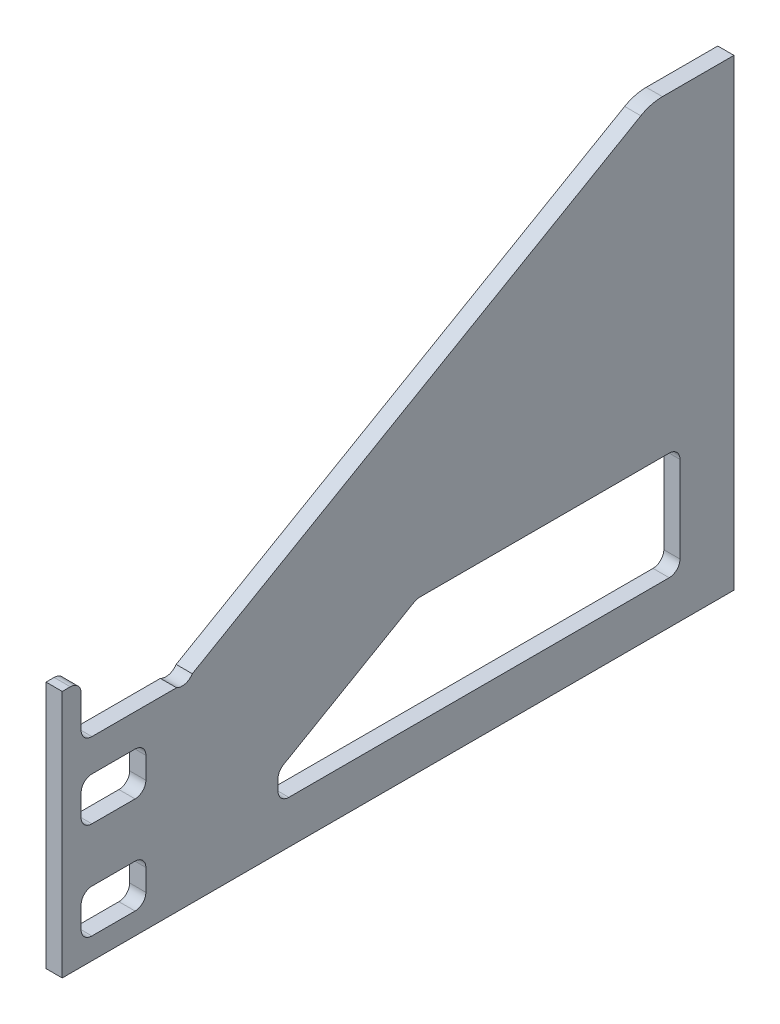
SolidWorks part; units mm, degrees
ref_plane "Front Plane" through (0, 0, 0) normal (0, 0, 1) x (1, 0, 0)
ref_plane "Top Plane" through (0, 0, 0) normal (0, 1, 0) x (1, 0, 0)
ref_plane "Right Plane" through (0, 0, 0) normal (1, 0, 0) x (0, 0, -1)
sketch "Sketch1" plane through (0, 0, 0) normal (1, 0, 0) x (0, 0, -1)
  line L0 (0, 137.6648) -> (0, 114.3)
  line L1 (-112.7125, 0) -> (282.575, 0)
  line L2 (0, 0) -> (248.4313, 143.4319) construction
  line L3 (0, 114.3) -> (-112.7125, 114.3)
  line L4 (282.575, 0) -> (282.575, 272.5765)
  line L5 (282.575, 272.5765) -> (233.6739, 272.5765)
  line L6 (233.6739, 272.5765) -> (0, 137.6648)
  line L7 (-112.7125, 114.3) -> (-112.7125, 0)
  dimension "D1" = 119.2212
  dimension "D2" = 269.8234
  dimension "D3" = 395.2875
  dimension "D4" = 30
  dimension "D5" = 114.3
  dimension "D6" = 112.7125
extrude "Boss-Extrude1" add sketch "Sketch1" along normal mid plane 9.525
sketch "Sketch11" plane through (4.7625, 0, 0) normal (1, 0, 0) x (0, 0, -1)
  line L0 (-112.7125, 114.3) -> (-112.7125, 0) construction
  line L1 (-95.25, 95.25) -> (-69.85, 95.25)
  line L2 (-101.6, 88.9) -> (-101.6, 76.2)
  line L3 (-95.25, 69.85) -> (-69.85, 69.85)
  line L4 (-63.5, 88.9) -> (-63.5, 76.2)
  line L5 (-95.25, 38.1) -> (-69.85, 38.1)
  line L6 (-101.6, 31.75) -> (-101.6, 19.05)
  line L7 (-95.25, 12.7) -> (-69.85, 12.7)
  line L8 (-63.5, 31.75) -> (-63.5, 19.05)
  line L9 (-112.7125, 0) -> (282.575, 0) construction
  line L10 (0, 114.3) -> (-112.7125, 114.3) construction
  arc A0 (-95.25, 38.1) -> (-101.6, 31.75) centre (-95.25, 31.75) ccw
  arc A1 (-101.6, 19.05) -> (-95.25, 12.7) centre (-95.25, 19.05) ccw
  arc A2 (-69.85, 12.7) -> (-63.5, 19.05) centre (-69.85, 19.05) ccw
  arc A3 (-63.5, 31.75) -> (-69.85, 38.1) centre (-69.85, 31.75) ccw
  arc A4 (-101.6, 76.2) -> (-95.25, 69.85) centre (-95.25, 76.2) ccw
  arc A5 (-69.85, 69.85) -> (-63.5, 76.2) centre (-69.85, 76.2) ccw
  arc A6 (-69.85, 95.25) -> (-63.5, 88.9) centre (-69.85, 88.9) cw
  arc A7 (-95.25, 95.25) -> (-101.6, 88.9) centre (-95.25, 88.9) ccw
  point P10 (-101.6, 38.1)
  point P13 (-101.6, 12.7)
  dimension "D4" = 6.35
  dimension "D1" = 31.75
  dimension "D2" = 25.4
  dimension "D3" = 25.4
  dimension "D5" = 38.1
  dimension "D6" = 11.1125
  dimension "D7" = 12.7
  dimension "D8" = 19.05
extrude "Cut-Extrude5" cut sketch "Sketch11" against normal through all
sketch "Sketch15" plane through (4.7625, 0, 0) normal (1, 0, 0) x (0, 0, -1)
  line L0 (94.4522, 88.0493) -> (17.4625, 43.5993)
  line L1 (97.6272, 88.9) -> (244.475, 88.9)
  line L2 (14.2875, 38.1) -> (14.2875, 31.75)
  line L3 (20.6375, 25.4) -> (244.475, 25.4)
  line L4 (250.825, 82.55) -> (250.825, 31.75)
  line L5 (233.6739, 272.5765) -> (0, 137.6648) construction
  line L6 (-112.7125, 0) -> (282.575, 0) construction
  line L7 (282.575, 0) -> (282.575, 272.5765) construction
  line L8 (-112.7125, 114.3) -> (-112.7125, 0) construction
  arc A0 (97.6272, 88.9) -> (94.4522, 88.0493) centre (97.6272, 82.55) ccw
  arc A1 (17.4625, 43.5993) -> (14.2875, 38.1) centre (20.6375, 38.1) ccw
  arc A2 (14.2875, 31.75) -> (20.6375, 25.4) centre (20.6375, 31.75) ccw
  arc A3 (244.475, 25.4) -> (250.825, 31.75) centre (244.475, 31.75) ccw
  arc A4 (250.825, 82.55) -> (244.475, 88.9) centre (244.475, 82.55) ccw
  dimension "D1" = 6.35
  dimension "D2" = 25.4
  dimension "D3" = 31.75
  dimension "D4" = 127
  dimension "D5" = 63.5
  dimension "D6" = 6.35
extrude "Cut-Extrude7" cut sketch "Sketch15" against normal through all
hole_wizard "#10-32 Tapped Hole2" positions "Sketch20" profile "Sketch19" tap size "#10-32" standard "ANSI Inch"
sketch "Sketch20" plane through (0, 0, -282.575) normal (0, 0, -1) x (-1, 0, 0)
  line L0 (0, 237.6515) -> (0, 125.1757) construction
  line L1 (0, 125.1757) -> (0, 12.7) construction
  line L3 (0, 0) -> (0, 12.7) construction
  line L4 (-4.7625, 0) -> (4.7625, 0) construction
  line L7 (-4.7625, 272.5765) -> (4.7625, 272.5765) construction
  point P0 (0, 237.6515)
  point P1 (0, 125.1757)
  point P3 (0, 12.7)
  dimension "D1" = 12.7
  dimension "D2" = 34.925
sketch "Sketch19" plane through (0, 237.6515, -282.575) normal (1, 0, 0) x (0, 1, 0)
  line L0 (0, 0) -> (0, 23.5145)
  line L1 (0, 23.5145) -> (2.0193, 22.3012)
  line L2 (2.0193, 22.3012) -> (2.0193, 0)
  line L5 (2.0193, 0) -> (0, 0)
  line L10 (0, 23.5145) -> (-2.0193, 22.3012) construction
  line L11 (0, -6.35) -> (0, 107.95) construction
  dimension "Tap Drill Dia." = 4.0386
  dimension "Tap Drill Depth" = 22.3012
  dimension "Drill Angle" = 118
sketch "Sketch21" plane through (-4.7625, 0, 0) normal (-1, 0, 0) x (0, 0, 1)
  line L0 (112.7125, 114.3) -> (112.7125, 146.05)
  line L1 (112.7125, 146.05) -> (101.6, 146.05)
  line L2 (101.6, 146.05) -> (101.6, 114.3)
  line L3 (0, 114.3) -> (112.7125, 114.3) construction
  line L4 (101.6, 114.3) -> (112.7125, 114.3)
  line L6 (101.6, 88.9) -> (101.6, 76.2) construction
  dimension "D1" = 31.75
extrude "Boss-Extrude2" add sketch "Sketch21" against normal up to surface (9.525 mm away)
fillet "Fillet4" radius 6.35 1 edges at (0, 146.05, 101.6)
hole_wizard "#10 Clearance Hole1" positions "Sketch14" profile "Sketch13" hole size "#10" standard "ANSI Inch"
sketch "Sketch14" plane through (0, 0, 112.7125) normal (0, 0, 1) x (1, 0, 0)
  line L0 (0, 25.4) -> (4.7625, 25.4) construction
  line L2 (4.7625, 31.75) -> (4.7625, 19.05) construction
  line L3 (0, 82.55) -> (4.7625, 82.55) construction
  line L5 (4.7625, 88.9) -> (4.7625, 76.2) construction
  line L6 (0, -149.9171) -> (0, 149.9171) construction
  line L7 (0, 127) -> (-4.7625, 127) construction
  line L9 (-4.7625, 139.7) -> (-4.7625, 114.3) construction
  point P0 (0, 82.55)
  point P1 (0, 25.4)
  point P18 (0, 127)
sketch "Sketch13" plane through (0, 82.55, 112.7125) normal (1, 0, 0) x (0, -1, 0)
  line L0 (0, 0) -> (0, 11.1125)
  line L1 (0, 11.1125) -> (2.8067, 11.1125)
  line L2 (2.8067, 11.1125) -> (2.8067, 0)
  line L5 (2.8067, 0) -> (0, 0)
  line L11 (0, -6.35) -> (0, 107.95) construction
  dimension "Thru Hole Dia." = 5.6134
  dimension "Thru Hole Depth" = 11.1125
hole_wizard "#10-32 Tapped Hole3" positions "Sketch23" profile "Sketch22" tap size "#10-32" standard "ANSI Inch"
sketch "Sketch23" plane through (-4.7625, 0, 0) normal (-1, 0, 0) x (0, 0, 1)
  circle A0 centre (58.5374, 101.6) radius 2.8067 construction
  point P0 (58.5374, 101.6)
  point P4 (-96.231, 101.6)
  point P7 (-203.4001, 101.6)
sketch "Sketch22" plane through (-4.7625, 101.6, 58.5374) normal (0, 1, 0) x (0, 0, 1)
  line L0 (0, 0) -> (0, 9.525)
  line L1 (0, 9.525) -> (2.0193, 9.525)
  line L2 (2.0193, 9.525) -> (2.0193, 0)
  line L5 (2.0193, 0) -> (0, 0)
  line L11 (0, -6.35) -> (0, 107.95) construction
  dimension "Thru Tap Drill Dia." = 4.0386
  dimension "Thru Tap Drill Depth" = 9.525
hole_wizard "#10-32 Tapped Hole4" positions "Sketch25" profile "Sketch24" tap size "#10-32" standard "ANSI Inch"
sketch "Sketch25" plane through (-4.7625, 0, 0) normal (-1, 0, 0) x (0, 0, 1)
  circle A0 centre (-254.8636, 119.0625) radius 2.8067 construction
  circle A1 centre (-254.8636, 157.1625) radius 2.8067 construction
  point P0 (-254.8636, 119.0625)
  point P4 (-254.8636, 157.1625)
sketch "Sketch24" plane through (-4.7625, 119.0625, -254.8636) normal (0, 1, 0) x (0, 0, 1)
  line L0 (0, 0) -> (0, 9.525)
  line L1 (0, 9.525) -> (2.0193, 9.525)
  line L2 (2.0193, 9.525) -> (2.0193, 0)
  line L5 (2.0193, 0) -> (0, 0)
  line L11 (0, -6.35) -> (0, 107.95) construction
  dimension "Thru Tap Drill Dia." = 4.0386
  dimension "Thru Tap Drill Depth" = 9.525
hole_wizard "#10-32 Tapped Hole6" positions "Sketch29" profile "Sketch28" tap size "#10-32" standard "ANSI Inch"
sketch "Sketch29" plane through (0, 272.5765, 0) normal (0, 1, 0) x (1, 0, 0)
  line L0 (4.7625, 282.575) -> (-4.7625, 282.575) construction
  line L1 (0, 282.575) -> (0, 269.875) construction
  line L2 (0, 269.875) -> (0, 242.8875) construction
  point P0 (0, 269.875)
  dimension "D1" = 12.7
sketch "Sketch28" plane through (0, 272.5765, -269.875) normal (1, 0, 0) x (0, 0, 1)
  line L0 (0, 0) -> (0, 23.4383)
  line L1 (0, 23.4383) -> (2.0193, 22.225)
  line L2 (2.0193, 22.225) -> (2.0193, 0)
  line L5 (2.0193, 0) -> (0, 0)
  line L10 (0, 23.4383) -> (-2.0193, 22.225) construction
  line L11 (0, -6.35) -> (0, 107.95) construction
  dimension "Tap Drill Dia." = 4.0386
  dimension "Tap Drill Depth" = 22.225
  dimension "Drill Angle" = 118
hole_wizard "1/4 Clearance Hole1" positions "Sketch35" profile "Sketch34" hole size "1/4" standard "ANSI Inch"
sketch "Sketch35" plane through (0, 103.2486, 59.6106) normal (0, 0.866, 0.5) x (1, 0, 0)
  line L0 (0, 125.9308) -> (0, 278.3308) construction
  line L2 (0, 202.1308) -> (-49.5237, 202.1308) construction
  line L4 (4.7625, 338.6558) -> (-4.7625, 338.6558) construction
  line L5 (0, 338.6558) -> (0, 278.3308) construction
  point P0 (0, 125.9308)
  point P1 (0, 278.3308)
  dimension "D1" = 152.4
  dimension "D2" = 136.525
sketch "Sketch34" plane through (0, 166.214, -49.4486) normal (1, 0, 0) x (0, -0.5, 0.866)
  line L0 (0, 0) -> (0, 10.0837)
  line L1 (0, 10.0837) -> (3.5719, 7.9375)
  line L2 (3.5719, 7.9375) -> (3.5719, 0)
  line L5 (3.5719, 0) -> (0, 0)
  line L10 (0, 10.0837) -> (-3.5719, 7.9375) construction
  line L11 (0, -6.35) -> (0, 107.95) construction
  dimension "Hole Dia." = 7.1437
  dimension "Hole Depth" = 7.9375
  dimension "Drill Angle" = 118
hole_wizard "M6x1.0 Tapped Hole1" positions "Sketch31" profile "Sketch30" tap size "M6x1.0" standard "ANSI Metric"
sketch "Sketch31" [suppressed] plane through (0, 103.2486, 59.6106) normal (0, 0.866, 0.5) x (1, 0, 0)
  line L0 (0, 338.6558) -> (0, 233.8808) construction
  line L1 (4.7625, 338.6558) -> (-4.7625, 338.6558) construction
  circle A0 centre (0, 278.3308) radius 3.5719 construction
  circle A1 centre (0, 125.9308) radius 3.5719 construction
  point P0 (0, 233.8808)
  point P9 (0, 170.3808)
  dimension "D1" = 44.45
  dimension "D2" = 44.45
sketch "Sketch30" plane through (0, 220.189, -142.9361) normal (1, 0, 0) x (0, -0.5, 0.866)
  line L0 (0, 0) -> (0, 23.7272)
  line L1 (0, 23.7272) -> (2.5, 22.225)
  line L2 (2.5, 22.225) -> (2.5, 0)
  line L5 (2.5, 0) -> (0, 0)
  line L10 (0, 23.7272) -> (-2.5, 22.225) construction
  line L11 (0, -6.35) -> (0, 107.95) construction
  dimension "Tap Drill Dia." = 5
  dimension "Tap Drill Depth" = 22.225
  dimension "Drill Angle" = 118
sketch "Sketch40" plane through (4.7625, 0, 0) normal (1, 0, 0) x (0, 0, -1)
  line L0 (0, 137.6648) -> (-40.469, 114.3)
  line L1 (0, 114.3) -> (-101.6, 114.3) construction
  line L2 (-40.469, 114.3) -> (0, 114.3)
  line L3 (0, 114.3) -> (0, 137.6648)
  line L4 (0, 137.6648) -> (0, 114.3) construction
  line L5 (233.6739, 272.5765) -> (0, 137.6648) construction
extrude "Boss-Extrude6" add sketch "Sketch40" against normal up to surface (9.525 mm away)
fillet "Fillet5" radius 25.4 1 edges at (0, 272.5765, -233.6739)
fillet "Fillet3" radius 6.35 2 edges at (0, 114.3, 101.6) (0, 114.3, 40.469)
hole_wizard "#10-32 Tapped Hole5" positions "Sketch27" profile "Sketch26" tap size "#10-32" standard "ANSI Inch"
sketch "Sketch27" plane through (0, 114.3, 0) normal (0, 1, 0) x (1, 0, 0)
  line L0 (0, 0) -> (0, -20.6375) construction
  line L1 (0, -20.6375) -> (0, -74.6125) construction
  line L3 (4.7625, -112.7125) -> (-4.7625, -112.7125) construction
  point P1 (0, -74.6125)
  dimension "D2" = 38.1
sketch "Sketch26" plane through (0, 114.3, 74.6125) normal (1, 0, 0) x (0, 0, 1)
  line L0 (0, 0) -> (0, 19.05)
  line L1 (0, 19.05) -> (2.0193, 19.05)
  line L2 (2.0193, 19.05) -> (2.0193, 0)
  line L5 (2.0193, 0) -> (0, 0)
  line L11 (0, -6.35) -> (0, 107.95) construction
  dimension "Thru Tap Drill Dia." = 4.0386
  dimension "Thru Tap Drill Depth" = 15.9512
hole_wizard "1/4-20 Tapped Hole1" positions "Sketch42" profile "Sketch41" tap size "1/4-20" standard "ANSI Inch"
sketch "Sketch42" plane through (0, 103.2486, 59.6106) normal (0, 0.866, 0.5) x (1, 0, 0)
  circle A0 centre (0, 125.9308) radius 3.5719 construction
  point P0 (0, 125.9308)
  point P5 (0, 278.3308)
sketch "Sketch41" plane through (0, 166.214, -49.4486) normal (1, 0, 0) x (0, -0.5, 0.866)
  line L0 (0, 0) -> (0, 33.2838)
  line L1 (0, 33.2838) -> (2.5527, 31.75)
  line L2 (2.5527, 31.75) -> (2.5527, 0)
  line L5 (2.5527, 0) -> (0, 0)
  line L10 (0, 33.2838) -> (-2.5527, 31.75) construction
  line L11 (0, -6.35) -> (0, 107.95) construction
  dimension "Tap Drill Dia." = 5.1054
  dimension "Tap Drill Depth" = 31.75
  dimension "Drill Angle" = 118
sketch "Sketch43" plane through (4.7625, 0, 0) normal (1, 0, 0) x (0, 0, -1)
  circle A0 centre (-42.1705, 120.65) radius 7.1438
  arc A1 (-42.1705, 114.3) -> (-38.9955, 115.1507) centre (-42.1705, 120.65) ccw construction
  dimension "D1" = 0.7937
extrude "Cut-Extrude8" cut sketch "Sketch43" against normal through all
